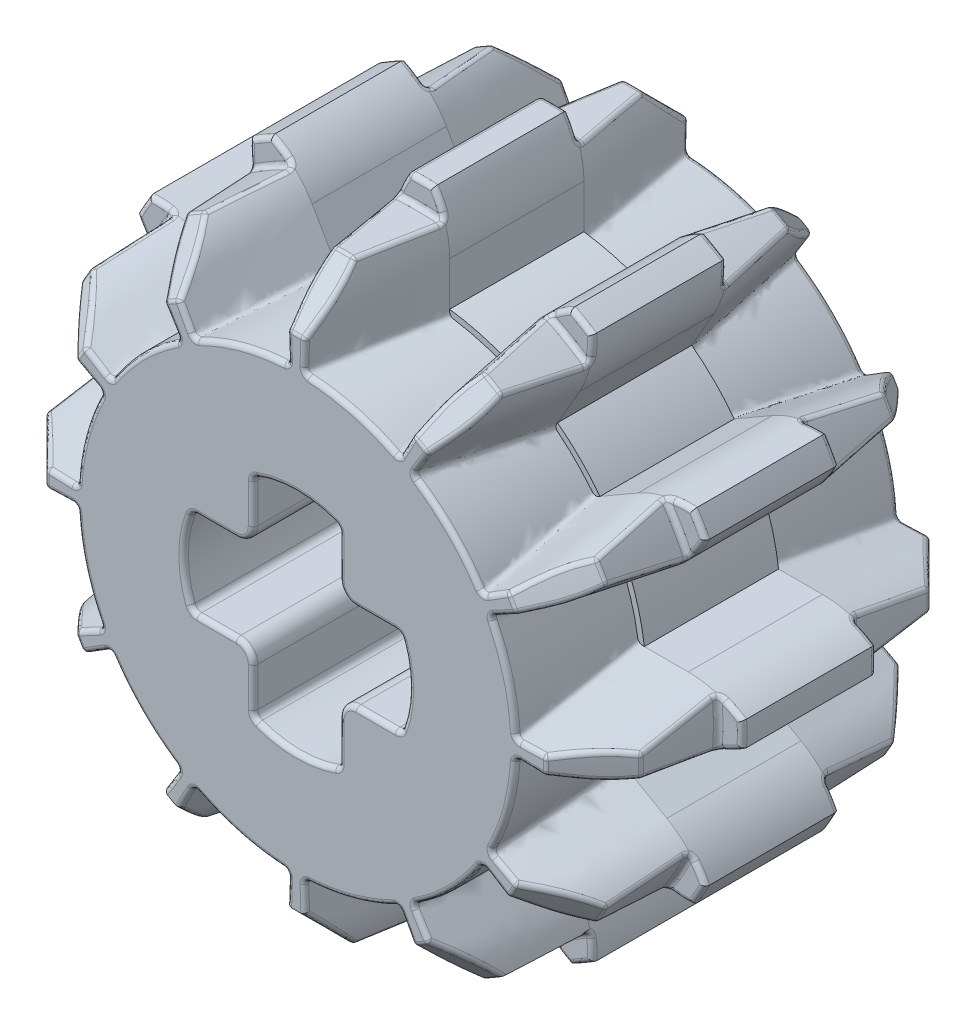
SolidWorks part; units mm, degrees
ref_plane "Front Plane" through (0, 0, 0) normal (0, 0, 1) x (1, 0, 0)
ref_plane "Top Plane" through (0, 0, 0) normal (0, 1, 0) x (1, 0, 0)
ref_plane "Right Plane" through (0, 0, 0) normal (1, 0, 0) x (0, 0, -1)
sketch "Sketch1" plane through (0, 0, 0) normal (1, 0, 0) x (0, 0, -1)
  line L0 (0, 5.2) -> (1, 6.2)
  line L1 (0, 0) -> (8, 0)
  line L2 (0, 0) -> (0, 5.2)
  line L3 (2.6, 6.7) -> (5.4, 6.7)
  line L4 (8, 0) -> (8, 5.2)
  line L5 (1, 6.2) -> (2.5, 6.2)
  line L6 (2.6, 6.3) -> (2.6, 6.7)
  line L7 (4, 0) -> (4, 6.7) construction
  line L8 (8, 5.2) -> (7, 6.2)
  line L9 (5.4, 6.3) -> (5.4, 6.7)
  line L10 (7, 6.2) -> (5.5, 6.2)
  arc A0 (5.4, 6.3) -> (5.5, 6.2) centre (5.5, 6.3) ccw
  arc A1 (2.5, 6.2) -> (2.6, 6.3) centre (2.5, 6.3) ccw
  point P15 (5.4, 6.2)
  point P18 (2.6, 6.2)
  dimension "D7" = 0.1
  dimension "D1" = 6.7
  dimension "D2" = 8
  dimension "D3" = 1.4
  dimension "D4" = 6.2
  dimension "D5" = 45
  dimension "D6" = 5.2
revolve "Revolve1" add sketch "Sketch1" angle 360 about L1
ref_plane "Plane1" through (0, 0, -4) normal (0, 0, 1) x (1, 0, 0)
sketch "Diameter" plane through (0, 0, -4) normal (0, 0, 1) x (1, 0, 0)
  circle A0 centre (0, 0) radius 6.7
  dimension "D1" = 13.4
sketch "Sketch2" plane through (0, 0, -4) normal (0, 0, 1) x (1, 0, 0)
  line L0 (0, 0) -> (0, 6.7) construction
  line L1 (0, 0) -> (-3.9755, 6.8857) construction
  line L2 (0, 0) -> (4.1674, 7.2182) construction
  line L4 (-2.2689, 5.1298) -> (-1.8112, 4.337)
  line L5 (-0.6, 5.577) -> (-0.6, 4.6615)
  circle A0 centre (0, 0) radius 6.7 construction
  circle A2 centre (0, 0) radius 5.75 construction
  arc A3 (-0.2583, 6.695) -> (-0.6, 5.577) centre (1.4, 5.577) ccw
  arc A5 (-0.2583, 6.695) -> (-3.1238, 5.9272) centre (0, 0) ccw
  arc A6 (-2.2689, 5.1298) -> (-3.1238, 5.9272) centre (-4.0009, 4.1298) ccw
  arc A7 (-0.6, 4.6615) -> (-1.8112, 4.337) centre (0, 0) ccw
  dimension "D5" = 4.7
  dimension "D6" = 11.5
  dimension "D7" = 4
  dimension "D8" = 1.2
  dimension "D9" = 2
  dimension "D3" = 6.7
  dimension "D1" = 30
  dimension "D2" = 30
  dimension "D4" = 0.6
extrude "Cut-Extrude1" cut sketch "Sketch2" against normal mid plane 10
pattern_circular "CirPattern1" count 12 over 360 about axis through (0, 0, 0) along (0, 0, 1) of "Cut-Extrude1"
ref_plane "Plane2" through (0, 0, -2.6) normal (0, 0, 1) x (1, 0, 0)
sketch "Sketch3" plane through (0, 0, -2.6) normal (0, 0, 1) x (1, 0, 0)
  line L0 (-3.1238, 5.9272) -> (-0.2583, 6.695)
  line L1 (0, 0) -> (-1.6911, 6.3111) construction
  line L2 (-1.7915, 4.303) -> (-2.2689, 5.1298)
  line L3 (-0.6, 4.6223) -> (-0.6, 5.577)
  arc A0 (-0.6, 4.6223) -> (-0.685, 4.5234) centre (-0.7, 4.6223) cw
  circle A1 centre (0, 0) radius 5.75 construction
  arc A2 (-1.7915, 4.303) -> (-1.6685, 4.2599) centre (-1.7049, 4.353) ccw
  arc A6 (-2.2689, 5.1298) -> (-3.1238, 5.9272) centre (-4.0009, 4.1298) ccw
  arc A7 (-0.685, 4.5234) -> (-1.6685, 4.2599) centre (0, 0) ccw
  arc A8 (-0.2583, 6.695) -> (-0.6, 5.577) centre (1.4, 5.577) ccw
  point P8 (-0.6, 4.5355)
  point P12 (-1.7481, 4.2278)
  dimension "D1" = 4.575
  dimension "D2" = 11.5
  dimension "D3" = 1.1886
  dimension "D4" = 0.1
sketch "Sketch4" plane through (0, 0, 0) normal (0, 0, 1) x (1, 0, 0)
  line L0 (-2.1943, 4.1268) -> (-2.5309, 4.7599)
  line L1 (-4.5428, 5.8058) -> (1.0313, 7.2994)
  line L2 (0, 0) -> (-1.6911, 6.3111) construction
  line L3 (-3.1238, 5.9272) -> (-0.2583, 6.695) construction
  line L4 (-1.6911, 6.3111) -> (0, 0) construction
  line L5 (-0.1631, 4.6711) -> (-0.1881, 5.3877)
  arc A0 (-2.5309, 4.7599) -> (-4.5428, 5.8058) centre (-4.2968, 3.821) ccw
  circle A1 centre (0, 0) radius 5.75 construction
  arc A2 (-0.2574, 4.5678) -> (-2.0609, 4.0845) centre (0, 0) ccw
  arc A3 (-0.1881, 5.3877) -> (1.0313, 7.2994) centre (1.8106, 5.4575) cw
  arc A4 (-0.1631, 4.6711) -> (-0.2574, 4.5678) centre (-0.2631, 4.6676) cw
  arc A5 (-2.1943, 4.1268) -> (-2.0609, 4.0845) centre (-2.106, 4.1738) ccw
  point P20 (-0.1597, 4.5722)
  point P23 (-2.1478, 4.0395)
  dimension "D1" = 13
  dimension "D2" = 4
  dimension "D4" = 4.575
  dimension "D5" = 0.1
  dimension "D3" = 0.25
loft "Cut-Loft1" cut profiles "Sketch3", "Sketch4"
pattern_circular "CirPattern3" count 12 over 360 about axis through (0, 0, 0) along (0, 0, 1) of "Cut-Loft1"
mirror "Mirror1" about plane through (0, 0, -4) normal (0, 0, 1) of "Cut-Loft1", "CirPattern3"
fillet "Fillet1" radius 0.1 43 edges at (0.373, 6.1888, -1.8886) (0.4926, 6.1991, -2.5582) (0.2065, 5.3267, -0.1307) (-3.35, 5.8024, -2.6) (-2.921, 5.8132, -2.6) (-0.3769, 6.4949, -2.6) (0, 6.7, -2.6) (0.3769, 6.4949, -2.6) (-0.4903, 6.2167, -2.5768) (-0.3481, 6.1902, -1.7508) (-0.2443, 5.5521, -0.3574) (-2.4845, 4.7163, -0.1307) (-2.7714, 5.5461, -1.8886) (-2.673, 5.6149, -2.5582) (-3.533, 5.1386, -2.5768) (-3.3966, 5.1868, -1.7508) (-2.9876, 4.6861, -0.3574) (-4.5098, 2.8421, -0.1307) (-3.5739, 5.4363, -2.6)
fillet "Fillet2" radius 0.1 216 edges at (5.3694, -3.1, -1) (5.1731, -3.4174, -1.8886) (5.1223, -3.5262, -2.5582) (3.533, -5.1386, -2.5768) (3.3966, -5.1868, -1.7508) (2.9876, -4.6861, -0.3574) (4.5098, -2.8421, -0.1307) (6.2, 0, -1) (6.1888, -0.373, -1.8886) (6.1991, -0.4926, -2.5582) (5.629, -2.6837, -2.5768) (5.535, -2.7936, -1.7508) (4.9304, -2.5645, -0.3574) (5.3267, -0.2065, -0.1307) (5.3694, 3.1, -1) (5.5461, 2.7714, -1.8886) (5.6149, 2.673, -2.5582) (6.2167, 0.4903, -2.5768) (6.1902, 0.3481, -1.7508) (5.5521, 0.2443, -0.3574) (4.7163, 2.4845, -0.1307) (3.1, 5.3694, -1) (3.4174, 5.1731, -1.8886) (3.5262, 5.1223, -2.5582) (5.1386, 3.533, -2.5768) (5.1868, 3.3966, -1.7508) (4.6861, 2.9876, -0.3574) (2.8421, 4.5098, -0.1307) (2.6837, 5.629, -2.5768) (2.7936, 5.535, -1.7508) (2.5645, 4.9304, -0.3574) (-6.7, 0, -2.6) (-6.4949, 0.3769, -2.6) (-5.8132, 2.921, -2.6) (-5.8024, -3.35, -2.6) (-5.8132, -2.921, -2.6) (-6.4949, -0.3769, -2.6) (2.3927, 4.319, 0) (-0.0873, 4.9367, 0) (-2.544, 4.2316, 0) (2.471, 4.6019, -0.0233) (-4.9378, 3.1501, -0.6571) (-4.1795, 2.6278, -0.0839) (-4.4399, 2.7321, -0.0132) (-2.9711, 5.4418, -1) (-3.1, 5.3694, -1) (-3.2272, 5.2939, -1) (-2.8744, 5.4934, -1.625) (-2.9165, 4.7351, -0.3612) (-2.6975, 5.0224, -0.501) (0.1479, 6.1982, -1) (0, 6.2, -1) (-0.1479, 6.1982, -1) (0.2574, 6.1947, -1.625) (0.1751, 5.6983, -0.501) (-0.1583, 5.559, -0.3612) (0.1552, 5.1849, -0.0197) (0.2106, 6.1757, -1.0081) (-2.7269, 4.4126, -0.0197) (-3.2703, 5.243, -1.0081) (-0.2106, 6.1757, -1.0081) (-0.1552, 5.1849, -0.0197) (-2.9055, 5.4536, -1.0081) (-2.458, 4.5678, -0.0197) (-3.35, -5.8024, -2.6) (-5.4363, -3.5739, -2.6) (0, -6.7, -2.6) (-0.3769, -6.4949, -2.6) (-2.921, -5.8132, -2.6) (3.35, -5.8024, -2.6) (2.921, -5.8132, -2.6) (0.3769, -6.4949, -2.6) (5.8024, -3.35, -2.6) (5.4363, -3.5739, -2.6) (3.5739, -5.4363, -2.6) (6.7, 0, -2.6) (6.4949, -0.3769, -2.6) (5.8132, -2.921, -2.6) (5.8024, 3.35, -2.6) (5.8132, 2.921, -2.6) (6.4949, 0.3769, -2.6) (3.35, 5.8024, -2.6) (3.5739, 5.4363, -2.6) (5.4363, 3.5739, -2.6) (2.921, 5.8132, -2.6) (-5.3694, 3.1, -1) (-5.1731, 3.4174, -1.8886) (-5.1223, 3.5262, -2.5582) (-6.2, 0, -1) (-6.1888, 0.373, -1.8886) (-6.1991, 0.4926, -2.5582) (-5.629, 2.6837, -2.5768) (-5.535, 2.7936, -1.7508) (-4.9304, 2.5645, -0.3574) (-5.3267, 0.2065, -0.1307) (-5.3694, -3.1, -1) (-5.5461, -2.7714, -1.8886) (-5.6149, -2.673, -2.5582) (-6.2167, -0.4903, -2.5768) (-6.1902, -0.3481, -1.7508) (-5.5521, -0.2443, -0.3574) (-4.7163, -2.4845, -0.1307) (-3.1, -5.3694, -1) (-3.4174, -5.1731, -1.8886) (-3.5262, -5.1223, -2.5582) (-5.1386, -3.533, -2.5768) (-5.1868, -3.3966, -1.7508) (-4.6861, -2.9876, -0.3574) (-2.8421, -4.5098, -0.1307) (-5.8024, 3.35, -2.6) (0, -6.2, -1) (-0.373, -6.1888, -1.8886) (-0.4926, -6.1991, -2.5582) (-2.6837, -5.629, -2.5768) (-2.7936, -5.535, -1.7508) (-2.5645, -4.9304, -0.3574) (-0.2065, -5.3267, -0.1307) (3.1, -5.3694, -1) (2.7714, -5.5461, -1.8886) (2.673, -5.6149, -2.5582) (0.4903, -6.2167, -2.5768) (0.3481, -6.1902, -1.7508) (0.2443, -5.5521, -0.3574) (2.4845, -4.7163, -0.1307) (-5.4363, 3.5739, -2.6)
fillet "Fillet4" radius 0.1 84 edges at (-0.2065, 5.3267, -7.8693) (-2.8421, 4.5098, -7.8693) (-4.7163, 2.4845, -7.8693) (-5.3267, -0.2065, -7.8693) (-4.5098, -2.8421, -7.8693) (-2.4845, -4.7163, -7.8693) (0.2065, -5.3267, -7.8693) (2.8421, -4.5098, -7.8693) (4.7163, -2.4845, -7.8693) (5.3267, 0.2065, -7.8693) (4.5098, 2.8421, -7.8693) (2.4845, 4.7163, -7.8693)
fillet "Fillet5" radius 0.1 72 edges at (-5.3694, -3.1, -7) (-4.9378, -3.1501, -7.3429) (-4.4399, -2.7321, -7.9868) (-4.6019, -2.471, -7.9767) (-4.9304, -2.5645, -7.6426) (-6.2, 0, -7) (-5.8513, -0.2592, -7.3429) (-5.2111, -0.1461, -7.9868) (-5.2208, 0.161, -7.9767) (-5.552, 0.2443, -7.6426) (-5.3694, 3.1, -7) (-5.197, 2.7012, -7.3429) (-4.586, 2.479, -7.9868) (-4.4409, 2.7498, -7.9767) (-4.6861, 2.9876, -7.6426) (-3.1, 5.3694, -7) (-3.1501, 4.9378, -7.3429) (-2.7321, 4.4399, -7.9868) (-2.471, 4.6019, -7.9767) (-2.5645, 4.9304, -7.6426) (-3.1, -5.3694, -7) (-2.7012, -5.197, -7.3429) (-2.479, -4.586, -7.9868) (-2.7498, -4.4409, -7.9767) (-2.9876, -4.6861, -7.6426) (0, -6.2, -7) (0.2592, -5.8513, -7.3429) (0.1461, -5.2111, -7.9868) (-0.161, -5.2208, -7.9767) (-0.2443, -5.552, -7.6426) (3.1, -5.3694, -7) (3.1501, -4.9378, -7.3429) (2.7321, -4.4399, -7.9868) (2.471, -4.6019, -7.9767) (2.5645, -4.9304, -7.6426) (0, 6.2, -7) (-0.2592, 5.8513, -7.3429) (-0.1461, 5.2111, -7.9868) (0.161, 5.2208, -7.9767) (0.2443, 5.552, -7.6426) (3.1, 5.3694, -7) (2.7012, 5.197, -7.3429) (2.479, 4.586, -7.9868) (2.7498, 4.4409, -7.9767) (2.9876, 4.6861, -7.6426) (5.3694, 3.1, -7) (4.9378, 3.1501, -7.3429) (4.4399, 2.7321, -7.9868) (4.6019, 2.471, -7.9767) (4.9304, 2.5645, -7.6426) (5.3694, -3.1, -7) (5.197, -2.7012, -7.3429) (4.586, -2.479, -7.9868) (4.4409, -2.7498, -7.9767) (4.6861, -2.9876, -7.6426) (6.2, 0, -7) (5.8513, 0.2592, -7.3429) (5.2111, 0.1461, -7.9868) (5.2208, -0.161, -7.9767) (5.552, -0.2443, -7.6426)
fillet "Fillet6" radius 0.1 64 edges at (2.9337, 5.4522, -6.9992) (2.673, 5.6149, -5.4418) (3.533, 5.1386, -5.4232) (3.2549, 5.2668, -6.9992) (6.2167, -0.4903, -5.4232) (6.1886, -0.1854, -6.9992) (5.2668, 3.2549, -6.9992) (5.1223, 3.5262, -5.4418) (5.629, 2.6837, -5.4232) (5.4522, 2.9337, -6.9992) (6.1886, 0.1854, -6.9992) (6.1991, 0.4926, -5.4418) (5.4522, -2.9337, -6.9992) (5.6149, -2.673, -5.4418) (5.1386, -3.533, -5.4232) (5.2668, -3.2549, -6.9992) (3.5739, 5.4363, -5.4) (3.35, 5.8024, -5.4) (2.921, 5.8132, -5.4) (2.7714, 5.5461, -6.1114) (3.3966, 5.1868, -6.2492) (6.1902, -0.3481, -6.2492) (5.1731, 3.4174, -6.1114) (5.4363, 3.5739, -5.4) (5.8024, 3.35, -5.4) (5.8132, 2.921, -5.4) (5.535, 2.7936, -6.2492) (6.1888, 0.373, -6.1114) (6.4949, 0.3769, -5.4) (6.7, 0, -5.4) (6.4949, -0.3769, -5.4) (5.8132, -2.921, -5.4) (5.5461, -2.7714, -6.1114) (5.1868, -3.3966, -6.2492) (5.4363, -3.5739, -5.4) (5.8024, -3.35, -5.4) (-3.2549, 5.2668, -6.9992) (-3.5262, 5.1223, -5.4418) (-2.6837, 5.629, -5.4232) (-2.9337, 5.4522, -6.9992) (-0.1854, 6.1886, -6.9992) (-0.4926, 6.1991, -5.4418) (0.4903, 6.2167, -5.4232) (0.1854, 6.1886, -6.9992) (-3.5739, 5.4363, -5.4) (-3.4174, 5.1731, -6.1114) (-2.7936, 5.535, -6.2492) (-3.35, 5.8024, -5.4) (0, 6.7, -5.4) (-0.373, 6.1888, -6.1114) (0.3481, 6.1902, -6.2492) (-2.921, 5.8132, -5.4) (0.3769, 6.4949, -5.4)
fillet "Fillet7" radius 0.1 70 edges at (-5.2668, -3.2549, -6.9992) (-5.1223, -3.5262, -5.4418) (-5.629, -2.6837, -5.4232) (-5.4522, -2.9337, -6.9992) (-6.1886, -0.1854, -6.9992) (-6.1991, -0.4926, -5.4418) (-6.2167, 0.4903, -5.4232) (-6.1886, 0.1854, -6.9992) (-5.4522, 2.9337, -6.9992) (-5.6149, 2.673, -5.4418) (-5.1386, 3.533, -5.4232) (-5.2668, 3.2549, -6.9992) (-0.2484, 6.6773, -2.6426) (-0.2583, 6.695, -4) (-0.269, 6.6789, -5.3537) (-5.8132, -2.921, -5.4) (-5.8024, -3.35, -5.4) (-5.4363, -3.5739, -5.4) (-5.1731, -3.4174, -6.1114) (-5.535, -2.7936, -6.2492) (-6.1888, -0.373, -6.1114) (-6.4949, -0.3769, -5.4) (-6.7, 0, -5.4) (-6.4949, 0.3769, -5.4) (-6.1902, 0.3481, -6.2492) (-5.4363, 3.5739, -5.4) (-5.8024, 3.35, -5.4) (-5.8132, 2.921, -5.4) (-5.5461, 2.7714, -6.1114) (-5.1868, 3.3966, -6.2492) (2.6837, -5.629, -5.4232) (2.9337, -5.4522, -6.9992) (3.2549, -5.2668, -6.9992) (3.5262, -5.1223, -5.4418) (0.1854, -6.1886, -6.9992) (0.4926, -6.1991, -5.4418) (-0.4903, -6.2167, -5.4232) (-0.1854, -6.1886, -6.9992) (-3.533, -5.1386, -5.4232) (-3.2549, -5.2668, -6.9992) (-2.9337, -5.4522, -6.9992) (-2.673, -5.6149, -5.4418) (2.921, -5.8132, -5.4) (2.7936, -5.535, -6.2492) (3.4174, -5.1731, -6.1114) (3.35, -5.8024, -5.4) (0.3769, -6.4949, -5.4) (0.373, -6.1888, -6.1114) (-0.3481, -6.1902, -6.2492) (0, -6.7, -5.4) (-3.35, -5.8024, -5.4) (-3.3966, -5.1868, -6.2492) (-2.7714, -5.5461, -6.1114) (-2.921, -5.8132, -5.4) (-3.5739, -5.4363, -5.4) (-0.3769, -6.4949, -5.4) (3.5739, -5.4363, -5.4)
sketch "Sketch5" plane through (0, 0, 0) normal (0, 0, 1) x (1, 0, 0)
  line L0 (-0.9, 2.0682) -> (-0.9, 1.25)
  line L1 (-2.0682, 0.9) -> (-1.25, 0.9)
  line L2 (-2.0682, -0.9) -> (-1.25, -0.9)
  line L3 (0.9, 2.0682) -> (0.9, 1.25)
  line L4 (0.9, -1.25) -> (0.9, -2.0682)
  line L5 (-0.9, -1.25) -> (-0.9, -2.0682)
  line L6 (1.25, 0.9) -> (2.0682, 0.9)
  line L7 (1.25, -0.9) -> (2.0682, -0.9)
  arc A0 (-2.2092, 0.8011) -> (-2.2092, -0.8011) centre (0, 0) ccw
  arc A1 (-0.8011, -2.2092) -> (0.8011, -2.2092) centre (0, 0) ccw
  arc A2 (2.2092, -0.8011) -> (2.2092, 0.8011) centre (0, 0) ccw
  arc A3 (0.8011, 2.2092) -> (-0.8011, 2.2092) centre (0, 0) ccw
  arc A4 (-0.9, -1.25) -> (-1.25, -0.9) centre (-1.25, -1.25) ccw
  arc A5 (0.9, -1.25) -> (1.25, -0.9) centre (1.25, -1.25) cw
  arc A6 (0.9, 1.25) -> (1.25, 0.9) centre (1.25, 1.25) ccw
  arc A7 (-0.9, 1.25) -> (-1.25, 0.9) centre (-1.25, 1.25) cw
  arc A8 (-0.9, 2.0682) -> (-0.8011, 2.2092) centre (-0.75, 2.0682) cw
  arc A9 (0.9, 2.0682) -> (0.8011, 2.2092) centre (0.75, 2.0682) ccw
  arc A10 (2.0682, 0.9) -> (2.2092, 0.8011) centre (2.0682, 0.75) cw
  arc A11 (2.0682, -0.9) -> (2.2092, -0.8011) centre (2.0682, -0.75) ccw
  arc A12 (0.9, -2.0682) -> (0.8011, -2.2092) centre (0.75, -2.0682) cw
  arc A13 (-0.9, -2.0682) -> (-0.8011, -2.2092) centre (-0.75, -2.0682) ccw
  arc A14 (-2.0682, -0.9) -> (-2.2092, -0.8011) centre (-2.0682, -0.75) cw
  arc A15 (-2.0682, 0.9) -> (-2.2092, 0.8011) centre (-2.0682, 0.75) ccw
  point P18 (0.9, -0.9)
  point P21 (0.9, 0.9)
  point P28 (0.9, 2.1708)
  point P31 (2.1708, 0.9)
  point P34 (2.1708, -0.9)
  point P37 (0.9, -2.1708)
  point P40 (-0.9, -2.1708)
  dimension "D1" = 4.7
  dimension "D6" = 0.35
  dimension "D7" = 0.15
  dimension "D2" = 0.9
  dimension "D3" = 1.8
  dimension "D4" = 0.9
  dimension "D5" = 1.8
extrude "Cut-Extrude2" cut sketch "Sketch5" against normal through all
fillet "Fillet8" radius 0.1 48 edges at (-2.1543, 0.8728, -8) (-1.6591, 0.9, -8) (-1.0025, 1.0025, -8) (-0.9, 1.6591, -8) (-0.8728, 2.1543, -8) (0, 2.35, -8) (0.8728, 2.1543, -8) (0.9, 1.6591, -8) (1.0025, 1.0025, -8) (1.6591, 0.9, -8) (2.1543, 0.8728, -8) (2.35, 0, -8) (2.1543, -0.8728, -8) (1.6591, -0.9, -8) (1.0025, -1.0025, -8) (0.9, -1.6591, -8) (0.8728, -2.1543, -8) (0, -2.35, -8) (-0.8728, -2.1543, -8) (-0.9, -1.6591, -8) (-1.0025, -1.0025, -8) (-1.6591, -0.9, -8) (-2.1543, -0.8728, -8) (0.8728, 2.1543, 0) (0.9, 1.6591, 0) (1.0025, 1.0025, 0) (1.6591, 0.9, 0) (2.1543, 0.8728, 0) (2.35, 0, 0) (2.1543, -0.8728, 0) (1.6591, -0.9, 0) (1.0025, -1.0025, 0) (0.9, -1.6591, 0) (0.8728, -2.1543, 0) (0, -2.35, 0) (-0.8728, -2.1543, 0) (-0.9, -1.6591, 0) (-1.0025, -1.0025, 0) (-1.6591, -0.9, 0) (-2.1543, -0.8728, 0) (-2.35, 0, 0) (-2.1543, 0.8728, 0) (-1.6591, 0.9, 0) (-1.0025, 1.0025, 0) (-0.9, 1.6591, 0) (-0.8728, 2.1543, 0) (-2.35, 0, -8) (0, 2.35, 0)
